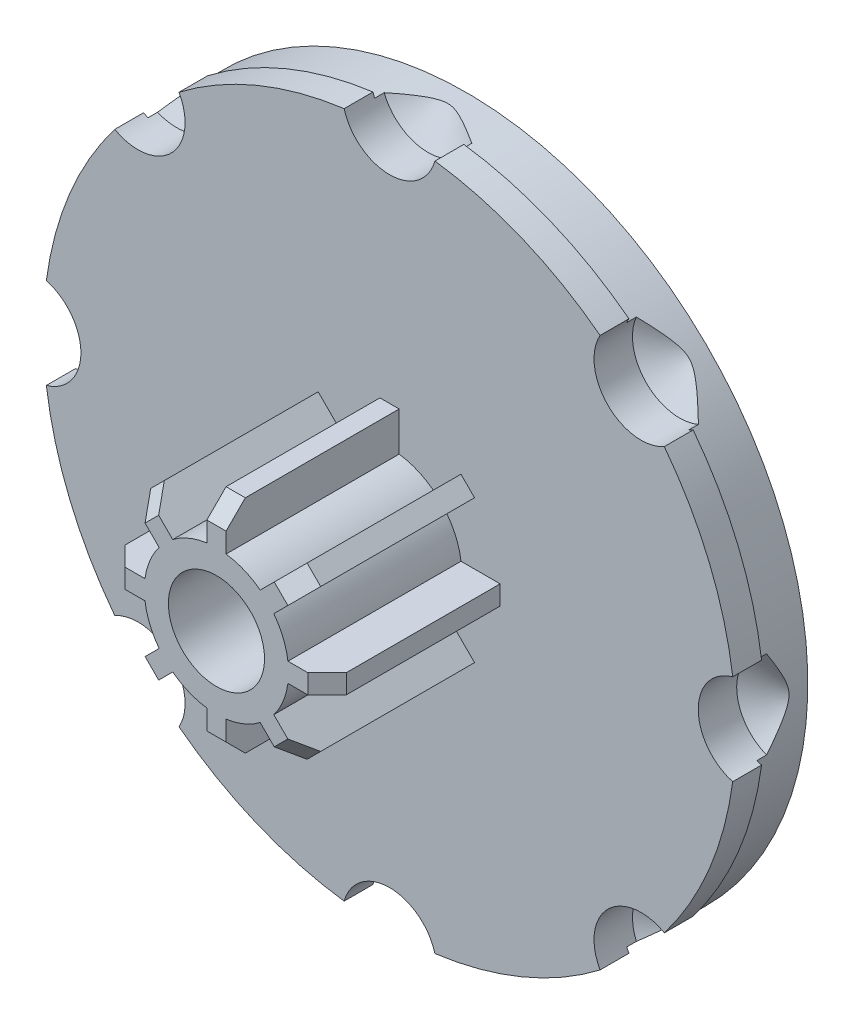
SolidWorks part; units mm, degrees
ref_plane "Front Plane" through (0, 0, 0) normal (0, 0, 1) x (1, 0, 0)
ref_plane "Top Plane" through (0, 0, 0) normal (0, 1, 0) x (1, 0, 0)
ref_plane "Right Plane" through (0, 0, 0) normal (1, 0, 0) x (0, 0, -1)
sketch "Sketch1" plane through (0, 0, 0) normal (0, 0, 1) x (1, 0, 0)
  circle A0 centre (0, 0) radius 18
  dimension "D1" = 36
extrude "Extrude1" add sketch "Sketch1" along normal blind 4
sketch "Sketch2" plane through (0, 0, 4) normal (0, 0, 1) x (1, 0, 0)
  circle A0 centre (0, 0) radius 3.75
  dimension "D1" = 7.5
extrude "Extrude2" add sketch "Sketch2" along normal blind 9
sketch "Sketch3" plane through (0, 0, 13) normal (0, 0, 1) x (1, 0, 0)
  circle A0 centre (0, 0) radius 2.5
  dimension "D1" = 5
sketch "Sketch4" plane through (0, 0, 4) normal (0, 0, 1) x (1, 0, 0)
  circle A0 centre (0, 18.5) radius 1.75
  dimension "D1" = 3.5
  dimension "D2" = 18.5
hole_wizard "Ø4.9 (4.9) Diameter Hole1" positions "3DSketch1" profile "Sketch5" hole size "Ø4.9" standard "ISO"
sketch3d "3DSketch1"
  point P0 (0, 18.5, 4)
sketch "Sketch5" plane through (0, 18.5, 4) normal (1, 0, 0) x (0, -1, 0)
  line L0 (0, 0) -> (0, 3.4721)
  line L1 (0, 3.4721) -> (2.45, 2)
  line L2 (2.45, 2) -> (2.45, 0)
  line L5 (2.45, 0) -> (0, 0)
  line L10 (0, 3.4721) -> (-2.45, 2) construction
  line L11 (0, -6.35) -> (0, 107.95) construction
  dimension "Hole Dia." = 4.9
  dimension "Hole Depth" = 2
  dimension "Drill Angle" = 118
pattern_circular "CirPattern1" count 8 over 360 about axis through (0, 0, 0) along (0, 0, 1) of "Ø4.9 (4.9) Diameter Hole1"
sketch "Sketch6" plane through (0, 0, 13) normal (0, 0, 1) x (1, 0, 0)
  line L0 (2.2744, 2.9815) -> (3.7123, 4.4194)
  line L1 (4.4194, 3.7123) -> (3.7123, 4.4194)
  line L2 (0.5, 3.7165) -> (0.5, 5.75)
  line L3 (0.5, 5.75) -> (-0.5, 5.75)
  line L4 (-0.5, 3.7165) -> (-0.5, 5.75)
  line L5 (0, 3.75) -> (-0.5, 5.75) construction
  line L6 (0.5, 5.75) -> (0, 3.75) construction
  line L7 (2.9815, 2.2744) -> (4.4194, 3.7123)
  line L8 (3.7165, 0.5) -> (5.75, 0.5)
  line L9 (5.75, -0.5) -> (5.75, 0.5)
  line L10 (3.7165, -0.5) -> (5.75, -0.5)
  line L11 (2.9815, -2.2744) -> (4.4194, -3.7123)
  line L12 (3.7123, -4.4194) -> (4.4194, -3.7123)
  line L13 (2.2744, -2.9815) -> (3.7123, -4.4194)
  line L14 (0.5, -3.7165) -> (0.5, -5.75)
  line L15 (-0.5, -5.75) -> (0.5, -5.75)
  line L16 (-0.5, -3.7165) -> (-0.5, -5.75)
  line L17 (-2.2744, -2.9815) -> (-3.7123, -4.4194)
  line L18 (-4.4194, -3.7123) -> (-3.7123, -4.4194)
  line L19 (-2.9815, -2.2744) -> (-4.4194, -3.7123)
  line L20 (-3.7165, -0.5) -> (-5.75, -0.5)
  line L21 (-5.75, 0.5) -> (-5.75, -0.5)
  line L22 (-3.7165, 0.5) -> (-5.75, 0.5)
  line L23 (-2.9815, 2.2744) -> (-4.4194, 3.7123)
  line L24 (-3.7123, 4.4194) -> (-4.4194, 3.7123)
  line L25 (-2.2744, 2.9815) -> (-3.7123, 4.4194)
  circle A0 centre (0, 0) radius 3.75 construction
  circle A1 centre (0, 0) radius 3.75 construction
  arc A2 (-2.9815, 2.2744) -> (-3.7165, 0.5) centre (0, 0) ccw
  arc A3 (-3.7165, -0.5) -> (-2.9815, -2.2744) centre (0, 0) ccw
  arc A4 (-2.2744, -2.9815) -> (-0.5, -3.7165) centre (0, 0) ccw
  arc A5 (0.5, -3.7165) -> (2.2744, -2.9815) centre (0, 0) ccw
  arc A6 (2.9815, -2.2744) -> (3.7165, -0.5) centre (0, 0) ccw
  arc A7 (3.7165, 0.5) -> (2.9815, 2.2744) centre (0, 0) ccw
  arc A8 (2.2744, 2.9815) -> (0.5, 3.7165) centre (0, 0) ccw
  arc A9 (-0.5, 3.7165) -> (-2.2744, 2.9815) centre (0, 0) ccw
  point P0 (0, 3.75)
  dimension "D1" = 2
  dimension "D2" = 1
extrude "Extrude5" add sketch "Sketch6" against normal up to surface (9 mm away)
chamfer "Chamfer1" distance 1 angle 45 8 edges at (-4.0659, 4.0659, 13) (-5.75, 0, 13) (-4.0659, -4.0659, 13) (0, -5.75, 13) (4.0659, -4.0659, 13) (5.75, 0, 13) (4.0659, 4.0659, 13) (0, 5.75, 13)
extrude "Extrude6" cut sketch "Sketch3" against normal through all
sketch "Sketch7" plane through (0, 0, 0) normal (0, 0, -1) x (-1, 0, 0)
  circle A0 centre (0, 0) radius 17.75
  dimension "D1" = 35.5
extrude "Cut-Extrude1" cut sketch "Sketch7" against normal blind 2.5 flip side to cut
